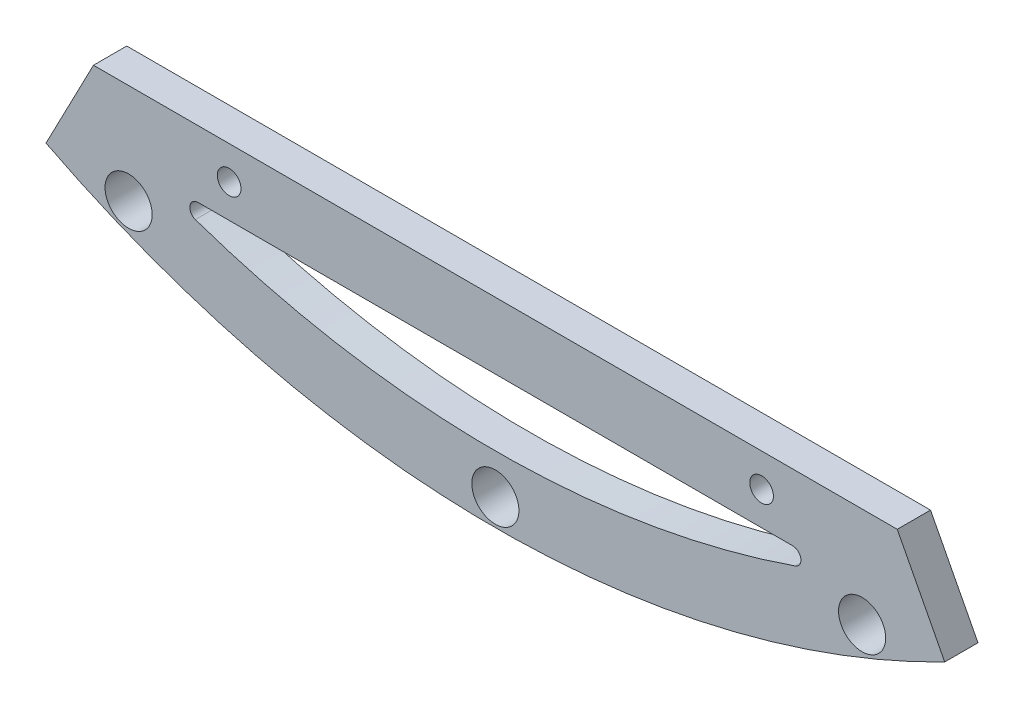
SolidWorks part; units mm, degrees
ref_plane "Front Plane" through (0, 0, 0) normal (0, 0, 1) x (1, 0, 0)
ref_plane "Top Plane" through (0, 0, 0) normal (0, 1, 0) x (1, 0, 0)
ref_plane "Right Plane" through (0, 0, 0) normal (1, 0, 0) x (0, 0, -1)
sketch "Sketch1" plane through (0, 0, 0) normal (0, 0, 1) x (1, 0, 0)
  line L0 (-34.9926, -84.4795) -> (0, 0) construction
  line L1 (0, 0) -> (34.9926, -84.4795) construction
  line L2 (0, 0) -> (0, -91.44) construction
  line L3 (-42.8741, -83.6304) -> (-38.345, -74.93)
  line L4 (38.345, -74.93) -> (42.8741, -83.6304)
  line L5 (-38.345, -74.93) -> (38.345, -74.93)
  line L6 (28.3625, -81.28) -> (-28.3625, -81.28)
  arc A0 (-42.8741, -83.6304) -> (42.8741, -83.6304) centre (0, 0) ccw
  arc A1 (-28.6218, -82.824) -> (28.6218, -82.824) centre (0, 0) ccw
  circle A2 centre (0, 0) radius 91.44 construction
  arc A3 (-28.3625, -81.28) -> (-28.6218, -82.824) centre (-28.3625, -82.0737) ccw
  arc A4 (28.3625, -81.28) -> (28.6218, -82.824) centre (28.3625, -82.0737) cw
  dimension "D1" = 187.96
  dimension "D2" = 175.26
  dimension "D3" = 182.88
  dimension "D10" = 0.7937
  dimension "D4" = 22.5
  dimension "D5" = 22.5
  dimension "D6" = 5
  dimension "D7" = 5
  dimension "D8" = 16.51
  dimension "D9" = 6.35
extrude "Extrude1" add sketch "Sketch1" along normal blind 3.175
hole_wizard "#8 Clearance Hole1" positions "Sketch7" profile "Sketch6" hole size "#8" standard "Ansi Inch"
sketch "Sketch7" plane through (0, 0, 0) normal (0, 0, -1) x (-1, 0, 0)
  point P1 (-34.9926, -84.4795)
  point P4 (34.9926, -84.4795)
  point P9 (0, -91.44)
sketch "Sketch6" plane through (34.9926, -84.4795, 0) normal (1, 0, 0) x (0, 1, 0)
  line L0 (0, 0) -> (0, 3.175)
  line L1 (0, 3.175) -> (2.2479, 3.175)
  line L2 (2.2479, 3.175) -> (2.2479, 0)
  line L5 (2.2479, 0) -> (0, 0)
  line L11 (0, -6.35) -> (0, 107.95) construction
  dimension "Thru Hole Dia." = 4.4958
  dimension "Thru Hole Depth" = 3.175
hole_wizard "#4-40 Tapped Hole1" positions "3DSketch3" profile "Sketch9" tap size "#4-40" standard "Ansi Inch"
sketch3d "3DSketch3"
  line L0 (-39.9978, -78.105, 3.175) -> (39.9978, -78.105, 3.175) construction
  line L1 (-38.345, -74.93, 3.175) -> (-42.8741, -83.6304, 3.175) construction
  line L2 (42.8741, -83.6304, 3.175) -> (38.345, -74.93, 3.175) construction
  line L5 (0, -78.105, 3.175) -> (0, -74.93, 3.175) construction
  line L6 (38.345, -74.93, 3.175) -> (-38.345, -74.93, 3.175) construction
  line L9 (0, -78.105, 3.175) -> (0, -81.28, 3.175) construction
  line L10 (28.3625, -81.28, 3.175) -> (-28.3625, -81.28, 3.175) construction
  point P35 (-25.4, -78.105, 3.175)
  point P50 (25.4, -78.105, 3.175)
  point P54 (-11.2036, -68.1871, 0)
  dimension "D1" = 25.4
  dimension "D2" = 25.4
sketch "Sketch9" plane through (-25.4, -78.105, 3.175) normal (1, 0, 0) x (0, -1, 0)
  line L0 (0, 0) -> (0, 3.175)
  line L1 (0, 3.175) -> (1.1303, 3.175)
  line L2 (1.1303, 3.175) -> (1.1303, 0)
  line L5 (1.1303, 0) -> (0, 0)
  line L11 (0, -6.35) -> (0, 107.95) construction
  dimension "Thru Tap Drill Dia." = 2.2606
  dimension "Thru Tap Drill Depth" = 3.175
